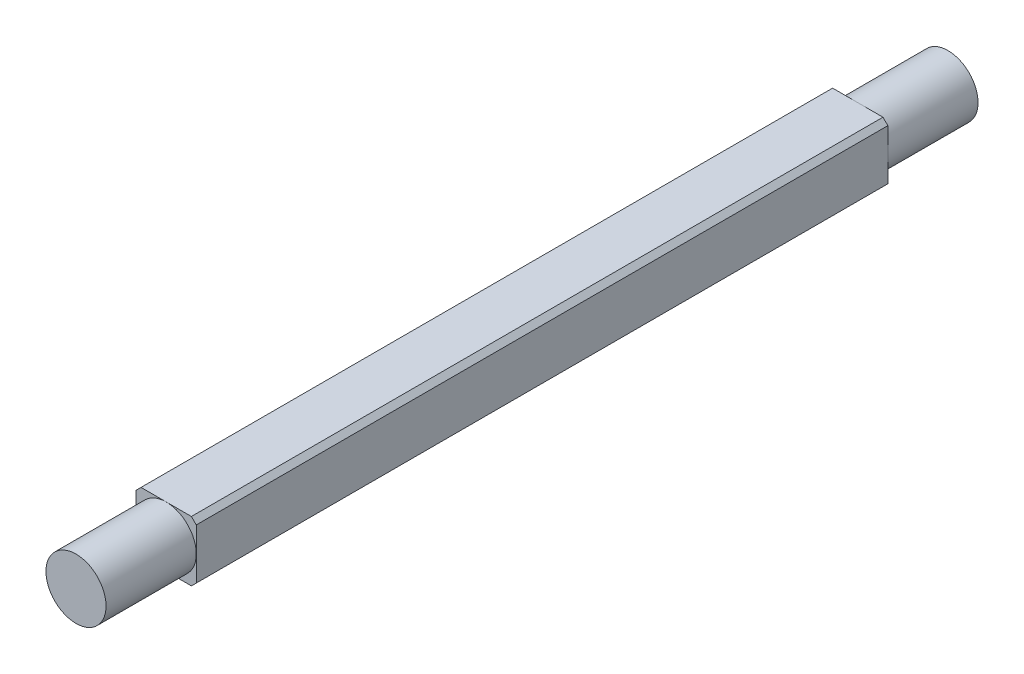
SolidWorks part; units mm, degrees
ref_plane "Front Plane" through (0, 0, 0) normal (0, 0, 1) x (1, 0, 0)
ref_plane "Top Plane" through (0, 0, 0) normal (0, 1, 0) x (1, 0, 0)
ref_plane "Right Plane" through (0, 0, 0) normal (1, 0, 0) x (0, 0, -1)
sketch "Sketch1" plane through (0, 0, 0) normal (0, 0, 1) x (1, 0, 0)
  line L1 (-4, 4) -> (4, 4)
  line L2 (-4, 4) -> (-4, -4)
  line L3 (-4, -4) -> (4, -4)
  line L4 (4, 4) -> (4, -4)
  line L5 (-4, 4) -> (4, -4) construction
  line L6 (-4, -4) -> (4, 4) construction
  point P0 (0, 0)
  dimension "D1" = 8
  dimension "D2" = 8
extrude "Boss-Extrude1" add sketch "Sketch1" along normal blind 92
chamfer "Chamfer1" distance 0.65 angle 45 4 edges at (4, 4, 46) (4, -4, 46) (-4, -4, 46) (-4, 4, 46)
sketch "Sketch2" plane through (0, 0, 0) normal (0, 0, -1) x (-1, 0, 0)
  circle A0 centre (0, 0) radius 4
  dimension "D1" = 8
sketch "Sketch3" plane through (0, 0, 92) normal (0, 0, 1) x (1, 0, 0)
  circle A0 centre (0, 0) radius 3.9982
extrude "Boss-Extrude3" add sketch "Sketch3" along normal blind 12
extrude "Boss-Extrude4" add sketch "Sketch2" along normal blind 12
